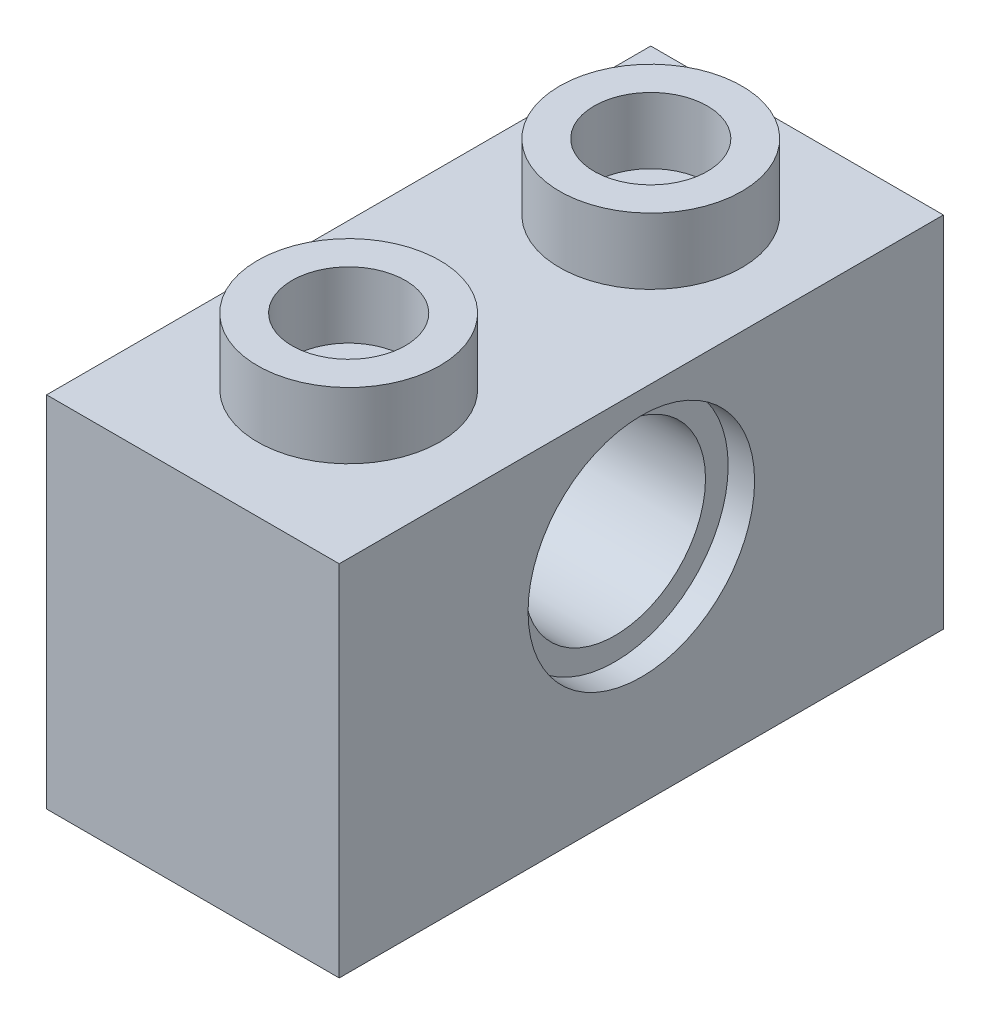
SolidWorks part; units mm, degrees
ref_plane "Front Plane" through (0, 0, 0) normal (0, 0, 1) x (1, 0, 0)
ref_plane "Top Plane" through (0, 0, 0) normal (0, 1, 0) x (1, 0, 0)
ref_plane "Right Plane" through (0, 0, 0) normal (1, 0, 0) x (0, 0, -1)
sketch "Sketch1" plane through (0, 0, 0) normal (0, 0, 1) x (1, 0, 0)
  line L1 (3.875, -4.75) -> (-3.875, -4.75)
  line L2 (3.875, -4.75) -> (3.875, 4.75)
  line L3 (3.875, 4.75) -> (-3.875, 4.75)
  line L4 (-3.875, -4.75) -> (-3.875, 4.75)
  line L5 (3.875, -4.75) -> (-3.875, 4.75) construction
  line L6 (3.875, 4.75) -> (-3.875, -4.75) construction
  point P0 (0, 0)
  dimension "D1" = 7.75
  dimension "D2" = 9.5
extrude "Boss-Extrude1" add sketch "Sketch1" along normal blind 16
sketch "Sketch2" plane through (0, 4.75, 0) normal (0, 1, 0) x (1, 0, 0)
  line L0 (0, 0) -> (0, -16.0835) construction
  line L1 (3.875, 0) -> (-3.875, 0) construction
  circle A0 centre (0, -3.875) radius 2.415
  circle A1 centre (0, -11.875) radius 2.415
  circle A2 centre (0, -3.875) radius 1.5
  circle A3 centre (0, -11.875) radius 1.5
  dimension "D1" = 4.83
  dimension "D2" = 4.83
  dimension "D3" = 3
  dimension "D4" = 3
  dimension "D5" = 8
  dimension "D6" = 3.875
extrude "Boss-Extrude2" add sketch "Sketch2" along normal blind 1.75
sketch "Sketch3" plane through (0, -4.75, 0) normal (0, -1, 0) x (1, 0, 0)
  line L0 (-3.875, 16) -> (3.875, 16) construction
  line L1 (-2.425, 14.55) -> (2.425, 14.55)
  line L2 (-2.425, 14.55) -> (-2.425, 1.45)
  line L3 (-2.425, 1.45) -> (2.425, 1.45)
  line L4 (2.425, 14.55) -> (2.425, 1.45)
  line L5 (-3.875, 0) -> (3.875, 0) construction
  line L6 (3.875, 16) -> (3.875, 0) construction
  line L7 (-3.875, 16) -> (-3.875, 0) construction
  dimension "D1" = 1.45
  dimension "D2" = 1.45
  dimension "D3" = 1.45
  dimension "D4" = 1.45
extrude "Cut-Extrude1" cut sketch "Sketch3" against normal blind 1.75
sketch "Sketch4" plane through (0, -3, 0) normal (0, -1, 0) x (1, 0, 0)
  line L0 (0, 14.55) -> (0, 1.45) construction
  line L1 (2.425, 14.55) -> (-2.425, 14.55) construction
  line L2 (-2.425, 1.45) -> (2.425, 1.45) construction
  circle A0 centre (0, 8) radius 1.5
  dimension "D1" = 3
extrude "Boss-Extrude3" add sketch "Sketch4" along normal blind 1.75
sketch "Sketch5" plane through (3.875, 0, 0) normal (1, 0, 0) x (0, 0, -1)
  line L0 (-16, 1.15) -> (0, 1.15) construction
  line L1 (-16, -4.75) -> (-16, 4.75) construction
  line L2 (0, -4.75) -> (0, 4.75) construction
  line L3 (-16, 4.75) -> (0, 4.75) construction
  circle A0 centre (-8, 1.15) radius 3
  dimension "D2" = 6
  dimension "D1" = 3.6
extrude "Cut-Extrude2" cut sketch "Sketch5" against normal blind 0.7
sketch "Sketch6" plane through (-3.875, 0, 0) normal (-1, 0, 0) x (0, 0, 1)
  circle A0 centre (8, 1.15) radius 3
  dimension "D1" = 6
extrude "Cut-Extrude3" cut sketch "Sketch6" against normal blind 0.7
sketch "Sketch7" plane through (-3.175, 0, 0) normal (-1, 0, 0) x (0, 0, 1)
  line L0 (16, 4.75) -> (0, 4.75) construction
  circle A0 centre (8, 1.15) radius 2.4
  dimension "D1" = 4.8
  dimension "D2" = 3.6
extrude "Cut-Extrude5" cut sketch "Sketch7" against normal through all
